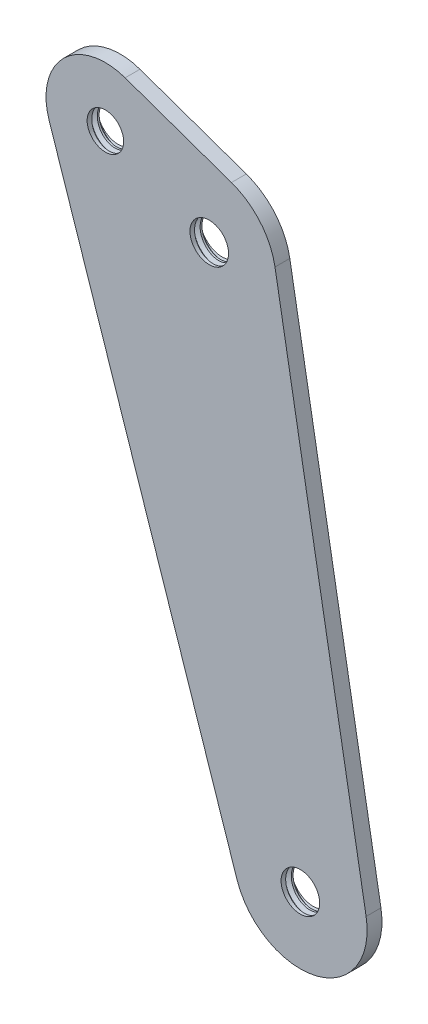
SolidWorks part; units mm, degrees
ref_plane "Alzado" through (0, 0, 0) normal (0, 0, 1) x (1, 0, 0)
ref_plane "Planta" through (0, 0, 0) normal (0, 1, 0) x (1, 0, 0)
ref_plane "Vista lateral" through (0, 0, 0) normal (1, 0, 0) x (0, 0, -1)
ref_plane "Plano1" through (0, 0, 4.2) normal (0, 0, 1) x (1, 0, 0)
sketch "Sk_Placa_jaula_exterior" plane through (0, 0, 4.2) normal (0, 0, 1) x (1, 0, 0)
  line L0 (-43.5893, -64.5304) -> (-18.2523, -140.5219)
  line L1 (-0.8511, -136.1123) -> (-13.1367, -66.4372)
  line L2 (-19.0055, -59.5128) -> (-33.3382, -54.4558)
  arc A0 (-18.2523, -140.5219) -> (-0.8511, -136.1123) centre (-9.7144, -137.6751) ccw
  arc A1 (-13.1367, -66.4372) -> (-19.0055, -59.5128) centre (-22, -68) ccw
  arc A2 (-33.3382, -54.4558) -> (-43.5893, -64.5304) centre (-36, -62) ccw
  circle A3 centre (-36, -62) radius 2.46
  circle A4 centre (-22, -68) radius 2.6
  circle A5 centre (-9.7144, -137.6751) radius 2.6
extrude "Placa_jaula_exterior" add sketch "Sk_Placa_jaula_exterior" along normal blind 2
thread "Rosca_M6x1" pitch 1 start angle 135, offset 0, length 2, pitch 1, diameter 4.92
ref_plane "Plano2" through (-34.2605, -60.2605, 6.2) normal (-0.7071, 0.7071, 0) x (0.7071, 0.7071, 0)
sketch "Perfil de rosca1" plane through (-34.2605, -60.2605, 6.2) normal (-0.7071, 0.7071, 0) x (0.7071, 0.7071, 0)
  line L0 (0, 0) -> (0, 1) construction
  line L1 (0, 0) -> (0.5413, 0.3125)
  line L2 (0.5413, 0.3125) -> (0.5413, 0.4375)
  line L3 (0.5413, 0.4375) -> (0, 0.75)
  line L4 (0.5413, 0.375) -> (0, 0.375) construction
  line L11 (0, 0) -> (0, 0.75)
  point P2 (0, 0)
  dimension "Pitch" = 1
  dimension "Profile_Angle" = 60
  dimension "Profile_Land" = 0.125
  dimension "Profile_Height" = 0.5413
thread "Rosca1" pitch 1 start angle 135, offset 0, length 2, pitch 1, diameter 5.2
ref_plane "Plano3" through (-7.8759, -135.8367, 6.2) normal (-0.7071, 0.7071, 0) x (0.7071, 0.7071, 0)
sketch "Perfil de rosca2" plane through (-7.8759, -135.8367, 6.2) normal (-0.7071, 0.7071, 0) x (0.7071, 0.7071, 0)
  line L0 (0, 0) -> (0, 1) construction
  line L1 (0, 0) -> (0.5413, 0.3125)
  line L2 (0.5413, 0.3125) -> (0.5413, 0.4375)
  line L3 (0.5413, 0.4375) -> (0, 0.75)
  line L4 (0.5413, 0.375) -> (0, 0.375) construction
  line L11 (0, 0) -> (0, 0.75)
  point P2 (0, 0)
  dimension "Pitch" = 1
  dimension "Profile_Angle" = 60
  dimension "Profile_Land" = 0.125
  dimension "Profile_Height" = 0.5413
thread "Rosca2" pitch 1 start angle 135, offset 0, length 2, pitch 1, diameter 5.2
ref_plane "Plano4" through (-20.1615, -66.1615, 6.2) normal (-0.7071, 0.7071, 0) x (0.7071, 0.7071, 0)
sketch "Perfil de rosca3" plane through (-20.1615, -66.1615, 6.2) normal (-0.7071, 0.7071, 0) x (0.7071, 0.7071, 0)
  line L0 (0, 0) -> (0, 1) construction
  line L1 (0, 0) -> (0.5413, 0.3125)
  line L2 (0.5413, 0.3125) -> (0.5413, 0.4375)
  line L3 (0.5413, 0.4375) -> (0, 0.75)
  line L4 (0.5413, 0.375) -> (0, 0.375) construction
  line L11 (0, 0) -> (0, 0.75)
  point P2 (0, 0)
  dimension "Pitch" = 1
  dimension "Profile_Angle" = 60
  dimension "Profile_Land" = 0.125
  dimension "Profile_Height" = 0.5413
